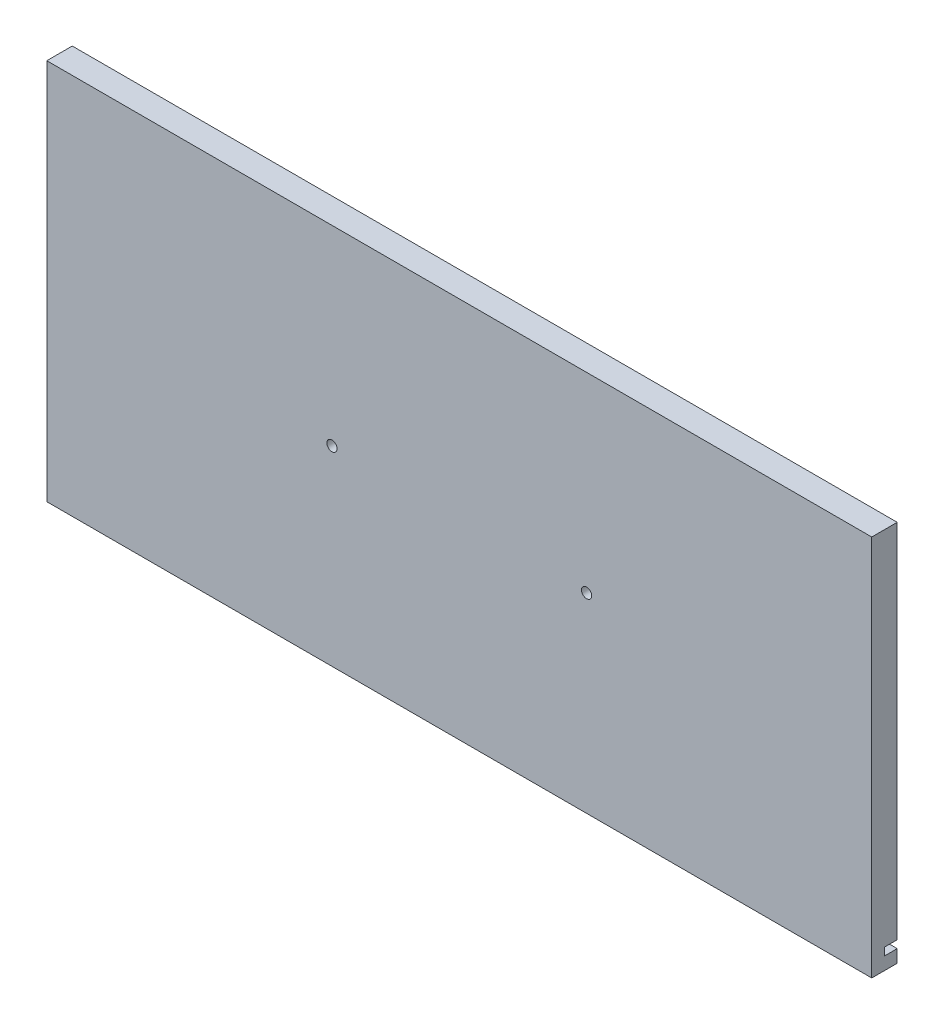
SolidWorks part; units mm, degrees
ref_plane "Front Plane" through (0, 0, 0) normal (0, 0, 1) x (1, 0, 0)
ref_plane "Top Plane" through (0, 0, 0) normal (0, 1, 0) x (1, 0, 0)
ref_plane "Right Plane" through (0, 0, 0) normal (1, 0, 0) x (0, 0, -1)
sketch "Sketch1" plane through (0, 0, 0) normal (0, 0, 1) x (1, 0, 0)
  line L1 (-162, -75) -> (162, -75)
  line L2 (-162, -75) -> (-162, 75)
  line L3 (-162, 75) -> (162, 75)
  line L4 (162, -75) -> (162, 75)
  line L5 (-162, -75) -> (162, 75) construction
  line L6 (-162, 75) -> (162, -75) construction
  point P0 (0, 0)
  dimension "D1" = 324
  dimension "D2" = 150
extrude "Boss-Extrude1" add sketch "Sketch1" along normal blind 10
sketch "Sketch2" plane through (0, 0, 0) normal (0, 0, -1) x (-1, 0, 0)
  line L0 (5, 0) -> (5, 121.1167) construction
  line L1 (-52.7827, -20) -> (0, -20) construction
  line L2 (162, -75) -> (-162, -75) construction
  line L3 (162, 75) -> (162, -75) construction
  circle A0 centre (-130.5, 17.5) radius 2.5
  circle A1 centre (140.5, 17.5) radius 2.5
  circle A2 centre (140.5, -57.5) radius 2.5
  circle A3 centre (-130.5, -57.5) radius 2.5
  dimension "D2" = 5
  dimension "D1" = 271
  dimension "D3" = 75
  dimension "D4" = 17.5
  dimension "D5" = 21.5
extrude "Cut-Extrude1" cut sketch "Sketch2" against normal blind 5
sketch "Sketch3" plane through (0, 0, 0) normal (0, 0, -1) x (-1, 0, 0)
  line L0 (162, 75) -> (162, -75) construction
  line L1 (162, -67) -> (-162, -67)
  line L2 (162, -67) -> (162, -70)
  line L3 (162, -70) -> (-162, -70)
  line L4 (-162, -67) -> (-162, -70)
  line L5 (-162, -75) -> (-162, 75) construction
  line L6 (162, -75) -> (-162, -75) construction
  dimension "D1" = 3
  dimension "D2" = 5
extrude "Cut-Extrude2" cut sketch "Sketch3" against normal blind 5
sketch "Sketch4" plane through (0, 0, 10) normal (0, 0, 1) x (1, 0, 0)
  line L0 (-50, 0) -> (50, 0) construction
  line L1 (0, 0) -> (0, 43.595) construction
  circle A0 centre (-50, 0) radius 2
  circle A1 centre (50, 0) radius 2
  dimension "D2" = 4
  dimension "D1" = 100
extrude "Cut-Extrude3" cut sketch "Sketch4" against normal blind 6
